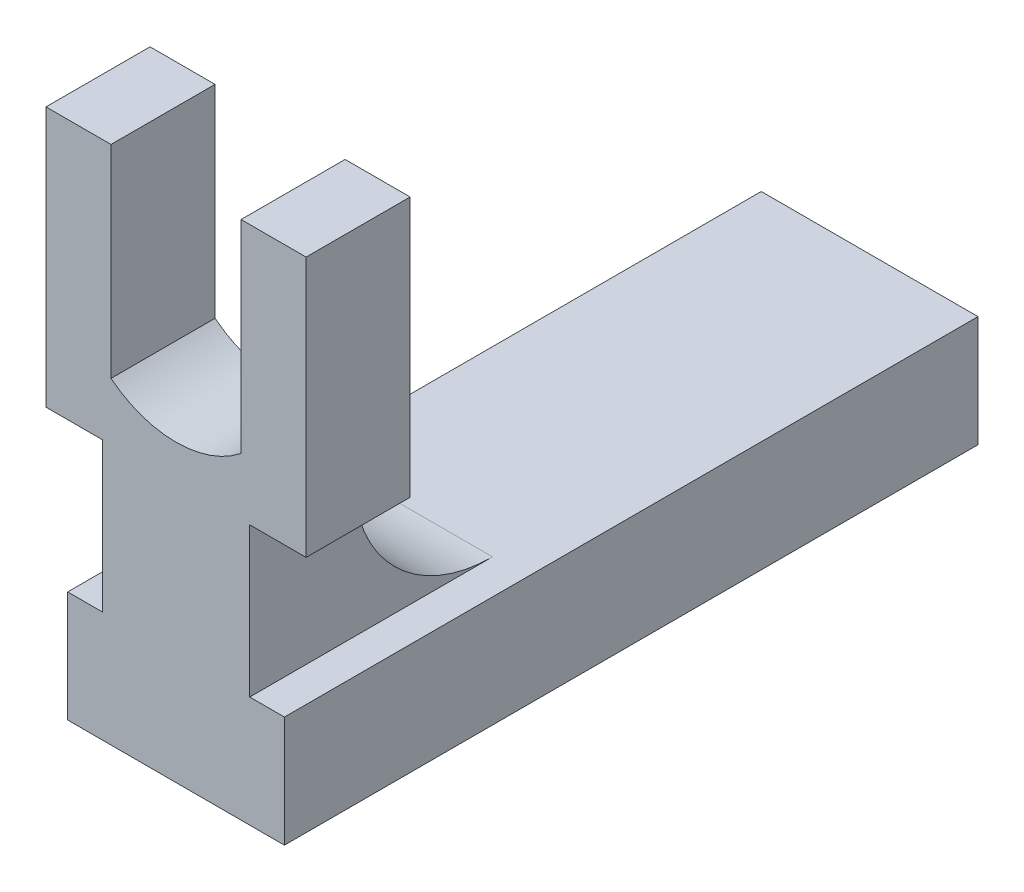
SolidWorks part; units mm, degrees
ref_plane "前视基准面" through (0, 0, 0) normal (0, 0, 1) x (1, 0, 0)
ref_plane "上视基准面" through (0, 0, 0) normal (0, 1, 0) x (1, 0, 0)
ref_plane "右视基准面" through (0, 0, 0) normal (1, 0, 0) x (0, 0, -1)
sketch "草图1" plane through (0, 0, 0) normal (0, 0, 1) x (1, 0, 0)
  line L0 (1.25, 0) -> (1.25, 6.4)
  line L1 (13.75, 0) -> (13.75, 6.4)
  line L2 (1.25, 0) -> (13.75, 0)
  line L3 (1.25, 6.4) -> (3.25, 6.4)
  line L4 (3.25, 6.4) -> (3.25, 15)
  line L5 (11.75, 6.4) -> (11.75, 15)
  line L6 (0, 15) -> (3.25, 15)
  line L7 (0, 30) -> (3.75, 30)
  line L8 (15, 15) -> (15, 30)
  line L9 (0, 15) -> (0, 30)
  line L10 (11.75, 6.4) -> (13.75, 6.4)
  line L11 (11.75, 15) -> (15, 15)
  line L12 (3.75, 18.3163) -> (3.75, 30)
  line L13 (11.25, 18.3163) -> (11.25, 30)
  line L14 (11.25, 30) -> (15, 30)
  arc A0 (3.75, 18.3163) -> (11.25, 18.3163) centre (7.5, 23) ccw
extrude "凸台-拉伸1" add sketch "草图1" along normal blind 40
sketch "草图2" plane through (15, 0, 0) normal (1, 0, 0) x (0, 0, -1)
  line L0 (-40, 0) -> (-40, 30)
  line L1 (0, 0) -> (0, 6.4)
  line L2 (-40, 0) -> (0, 0)
  line L3 (-26, 6.4) -> (0, 6.4)
  line L4 (-40, 30) -> (-34, 30)
  line L5 (-34, 14.4) -> (-34, 30)
  arc A0 (-34, 14.4) -> (-26, 6.4) centre (-26, 14.4) ccw
extrude "切除-拉伸1" cut sketch "草图2" against normal blind 40 flip side to cut
